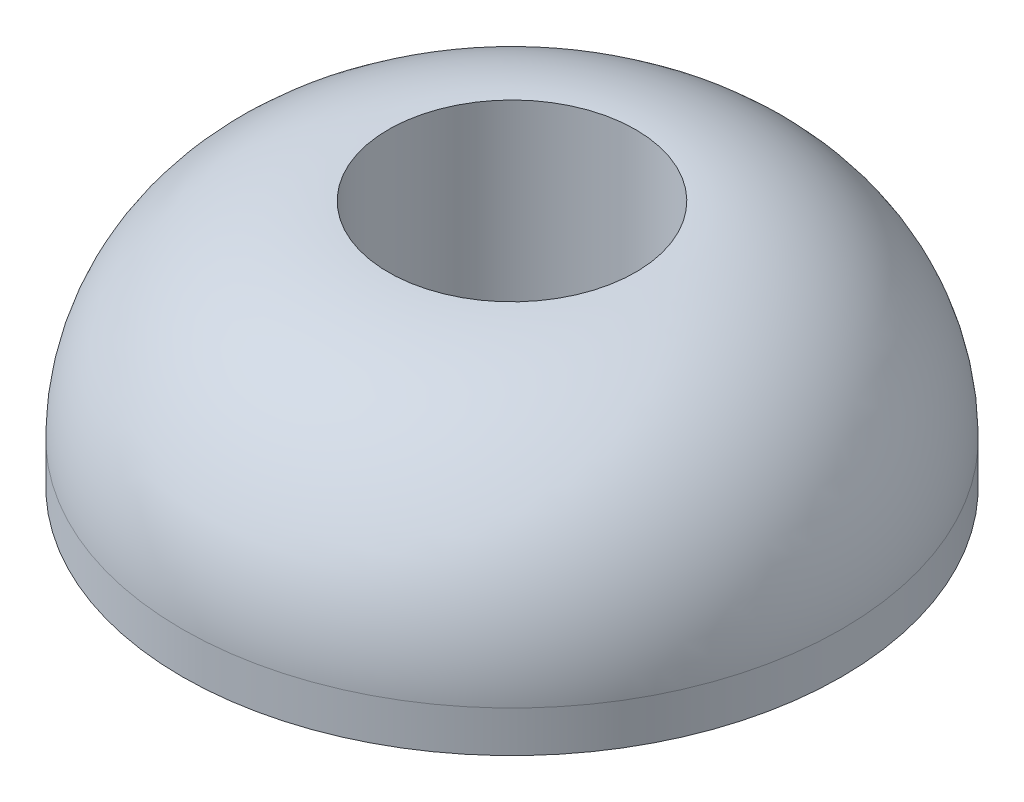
SolidWorks part; units mm, degrees
ref_plane "Plan de face" through (0, 0, 0) normal (0, 0, 1) x (1, 0, 0)
ref_plane "Plan de dessus" through (0, 0, 0) normal (0, 1, 0) x (1, 0, 0)
ref_plane "Plan de droite" through (0, 0, 0) normal (1, 0, 0) x (0, 0, -1)
sketch "Esquisse1" plane through (0, 0, 0) normal (0, 0, 1) x (1, 0, 0)
  line L0 (-13.5675, 0) -> (27.9608, 0) construction
  line L1 (-13.5675, 6) -> (27.9608, 6) construction
  line L2 (0, -4.4527) -> (0, 9.486) construction
  line L3 (3, 9.486) -> (3, -4.4527) construction
  line L4 (8, -4.4527) -> (8, 8) construction
  line L5 (-5.167, 1) -> (5.5075, 1) construction
  line L6 (3, 1) -> (3, 6)
  line L7 (8, 1) -> (8, 0)
  arc A0 (3, 6) -> (8, 1) centre (3, 1) cw
revolve "Révol.-Mince2" add sketch "Esquisse1" angle 360 about L2
